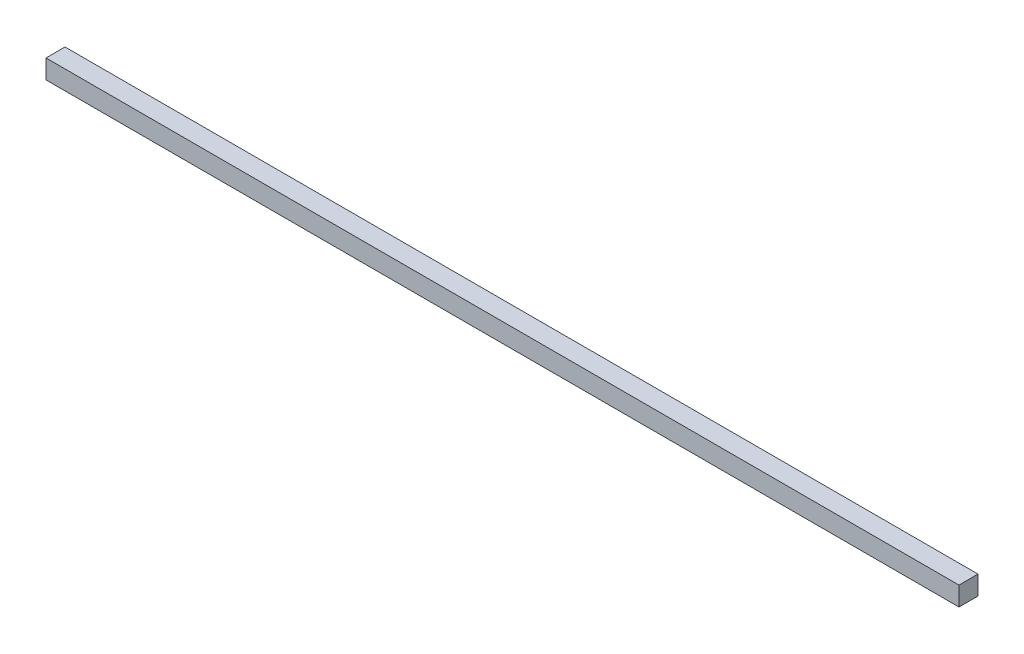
SolidWorks part; units mm, degrees
ref_plane "Front Plane" through (0, 0, 0) normal (0, 0, 1) x (1, 0, 0)
ref_plane "Top Plane" through (0, 0, 0) normal (0, 1, 0) x (1, 0, 0)
ref_plane "Right Plane" through (0, 0, 0) normal (1, 0, 0) x (0, 0, -1)
sketch "Sketch1" plane through (0, 0, 0) normal (0, 0, 1) x (1, 0, 0)
  line L1 (-58.3032, 19.8419) -> (246.4968, 19.8419)
  line L2 (-58.3032, 19.8419) -> (-58.3032, 13.4919)
  line L3 (-58.3032, 13.4919) -> (246.4968, 13.4919)
  line L4 (246.4968, 19.8419) -> (246.4968, 13.4919)
  dimension "D1" = 304.8
  dimension "D2" = 6.35
extrude "Boss-Extrude1" add sketch "Sketch1" along normal blind 6.35
